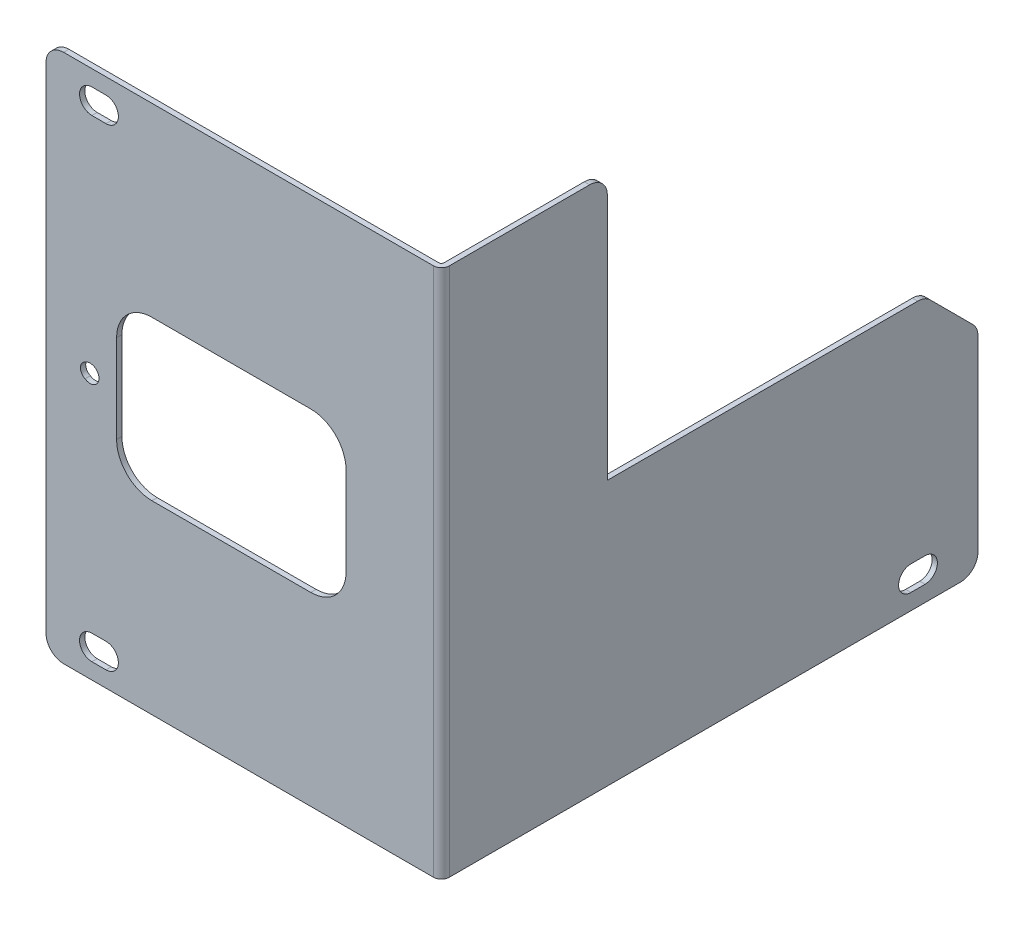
SolidWorks part; units mm, degrees
ref_plane "Plan de face" through (0, 0, 0) normal (0, 0, 1) x (1, 0, 0)
ref_plane "Plan de dessus" through (0, 0, 0) normal (0, 1, 0) x (1, 0, 0)
ref_plane "Plan de droite" through (0, 0, 0) normal (1, 0, 0) x (0, 0, -1)
ref_plane "Plan1" through (1.5, 0, 0) normal (1, 0, 0) x (0, 0, -1)
sketch "Esquisse1" plane through (1.5, 0, 0) normal (1, 0, 0) x (0, 0, -1)
  line L0 (135.5, 0) -> (-1.5, 0)
  line L1 (-1.5, 0) -> (-1.5, -75)
  line L2 (-1.5, -75) -> (150.5, -75)
  line L3 (150.5, -75) -> (150.5, -15)
  line L4 (150.5, -15) -> (135.5, 0)
extrude "Boss.-Extru.1" add sketch "Esquisse1" against normal blind 1.5
sketch "Esquisse2" plane through (0, 0, 0) normal (0, 1, 0) x (-1, 0, 0)
  line L0 (0, 1.5) -> (0, -45.5)
  line L1 (0, -45.5) -> (-1.5, -45.5)
  line L2 (-1.5, -45.5) -> (-1.5, 1.5)
  line L3 (-1.5, 1.5) -> (0, 1.5)
extrude "Boss.-Extru.2" add sketch "Esquisse2" along normal blind 75
sketch "Esquisse3" plane through (0, 0, 0) normal (-1, 0, 0) x (0, 0, 1)
  line L0 (1.5, 75) -> (1.5, -75)
  line L1 (1.5, -75) -> (0, -75)
  line L2 (0, -75) -> (0, 75)
  line L3 (0, 75) -> (1.5, 75)
extrude "Boss.-Extru.3" add sketch "Esquisse3" along normal blind 110.5
hole_wizard "Diamètre du perçage Ø4.5 (4.5)1" positions "Esquisse5" profile "Esquisse4" hole size "Ø4.5" standard "Ansi Metric"
sketch "Esquisse5" plane through (0, 0, 0) normal (0, 0, -1) x (-1, 0, 0)
  point P0 (98.5, 0)
sketch "Esquisse4" plane through (-98.5, 0, 0) normal (1, 0, 0) x (0, 1, 0)
  line L0 (0, 0) -> (0, 1.5)
  line L1 (0, 1.5) -> (2.25, 1.5)
  line L2 (2.25, 1.5) -> (2.25, 0)
  line L5 (2.25, 0) -> (0, 0)
  line L10 (0, 1.5) -> (-2.25, 1.5) construction
  line L11 (0, -6.35) -> (0, 107.95) construction
  dimension "Diamètre du perçage" = 4.5
  dimension "Profondeur du perçage" = 1.5
  dimension "Angle de pointe" = 180
sketch "Esquisse6" plane through (0, 0, 0) normal (0, 0, -1) x (-1, 0, 0)
  line L0 (97.5, -63.5) -> (93.5, -63.5)
  line L1 (93.5, -70.5) -> (97.5, -70.5)
  arc A0 (93.5, -63.5) -> (93.5, -70.5) centre (93.5, -67) ccw
  arc A1 (97.5, -70.5) -> (97.5, -63.5) centre (97.5, -67) ccw
extrude "Enlèv. mat.-Extru.1" cut sketch "Esquisse6" against normal through all
sketch "Esquisse7" plane through (0, 0, 0) normal (0, 0, -1) x (-1, 0, 0)
  line L0 (97.5, 70.5) -> (93.5, 70.5)
  line L1 (93.5, 63.5) -> (97.5, 63.5)
  arc A0 (93.5, 70.5) -> (93.5, 63.5) centre (93.5, 67) ccw
  arc A1 (97.5, 63.5) -> (97.5, 70.5) centre (97.5, 67) ccw
extrude "Enlèv. mat.-Extru.2" cut sketch "Esquisse7" against normal through all
sketch "Esquisse8" plane through (0, 0, 0) normal (0, 0, -1) x (-1, 0, 0)
  line L0 (25.5, 22.5) -> (25.5, -22.5)
  line L1 (25.5, -22.5) -> (90.5, -22.5)
  line L2 (90.5, -22.5) -> (90.5, 22.5)
  line L3 (90.5, 22.5) -> (25.5, 22.5)
extrude "Enlèv. mat.-Extru.3" cut sketch "Esquisse8" against normal through all
sketch "Esquisse9" plane through (0, 0, 0) normal (-1, 0, 0) x (0, 0, 1)
  line L0 (-131.5, -63.5) -> (-135.5, -63.5)
  line L1 (-135.5, -70.5) -> (-131.5, -70.5)
  arc A0 (-135.5, -63.5) -> (-135.5, -70.5) centre (-135.5, -67) ccw
  arc A1 (-131.5, -70.5) -> (-131.5, -63.5) centre (-131.5, -67) ccw
extrude "Enlèv. mat.-Extru.4" cut sketch "Esquisse9" against normal through all
ref_plane "Plan2" through (0, 0, 0) normal (0, -1, 0) x (1, 0, 0)
sketch "Esquisse10" plane through (0, 0, 0) normal (0, -1, 0) x (1, 0, 0)
  line L0 (-95.5, 1.5) -> (-98, 1.5)
  line L1 (-98, 1.5) -> (-98, 0)
  line L2 (-98, 0) -> (-95.5, 0)
  line L3 (-95.5, 0) -> (-95.5, 1.5)
  line L4 (-98, 1.5) -> (-98, 0) construction
revolve "Enlèvement de matière-Révolution1" cut sketch "Esquisse10" angle 360 about L4
fillet "Congé1" radius 0.75 1 edges
fillet "Congé2" radius 2.25 1 edges at (1.5, 0, 1.5)
fillet "Congé3" radius 5 6 edges at (0.75, 75, -45.5) (0.75, -15, -150.5) (0.75, 0, -135.5) (-110.5, -75, 0.75) (0.75, -75, -150.5) (-110.5, 75, 0.75)
fillet "Congé4" radius 10 4 edges at (-25.5, 22.5, 0.75) (-25.5, -22.5, 0.75) (-90.5, -22.5, 0.75) (-90.5, 22.5, 0.75)
sketch "Esquisse11" plane through (0, 0, 0) normal (-1, 0, 0) x (0, 0, 1)
  line L0 (-128, -67) -> (-139, -67)
  arc A0 (-131.5, -70.5) -> (-131.5, -63.5) centre (-131.5, -67) ccw construction
  arc A1 (-135.5, -63.5) -> (-135.5, -70.5) centre (-135.5, -67) ccw construction
sketch "Esquisse12" plane through (0, 0, 1.5) normal (0, 0, 1) x (1, 0, 0)
  point P0 (-98, 0)
sketch "Esquisse14" plane through (0, 0, 0) normal (0, 0, -1) x (-1, 0, 0)
  line L0 (100.75, 0) -> (95.5, 0)
  arc A0 (99.4375, -2.0454) -> (99.4375, 2.0454) centre (98.5, 0) ccw construction
  arc A1 (99.4375, 2.0454) -> (99.4375, -2.0454) centre (98, 0) ccw construction
